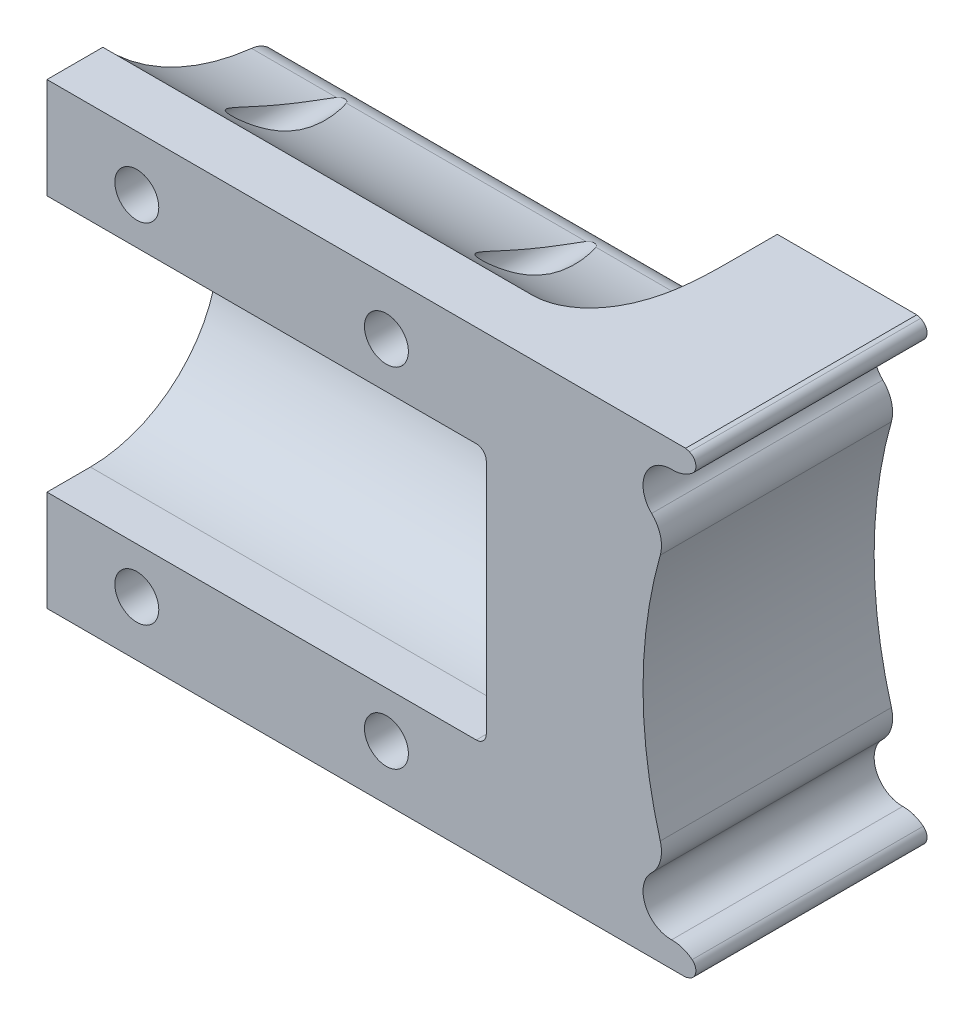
SolidWorks part; units mm, degrees
ref_plane "Front Plane" through (0, 0, 0) normal (1, 0, 0) x (0, 1, 0)
ref_plane "Top Plane" through (0, 0, 0) normal (0, 0, 1) x (0, 1, 0)
ref_plane "Right Plane" through (0, 0, 0) normal (0, 1, 0) x (-1, 0, 0)
sketch "Sketch1" plane through (0, 0, 0) normal (1, 0, 0) x (0, 1, 0)
  line L0 (-11.9398, 0) -> (-22.9398, 0)
  line L1 (-22.9398, 0) -> (-22.9398, -6)
  line L2 (-15.25, -23.55) -> (15.25, -23.55)
  line L3 (11.9398, 0) -> (22.9398, 0)
  line L4 (22.9398, 0) -> (22.9398, -6)
  arc A0 (-11.9398, 0) -> (11.9398, 0) centre (0, -4.75) ccw
  arc A1 (-22.9398, -6) -> (-15.25, -23.55) centre (-39.1215, -23.55) cw
  arc A3 (22.9398, -6) -> (15.25, -23.55) centre (39.1215, -23.55) ccw
  point P8 (0, -23.55)
  dimension "D2" = 12.85
  dimension "D5" = 30.5
  dimension "D1" = 4.75
  dimension "D3" = 11
  dimension "D4" = 6
  dimension "D6" = 23.55
extrude "Boss-Extrude1" add sketch "Sketch1" along normal blind 50
sketch "Sketch2" plane through (50, 0, 0) normal (1, 0, 0) x (0, 1, 0)
  line L0 (-11.9398, 0) -> (11.9398, 0)
  arc A2 (-11.9398, 0) -> (11.9398, 0) centre (0, -4.75) ccw
  arc A3 (-11.9398, 0) -> (11.9398, 0) centre (0, -4.75) ccw
  dimension "D1" = 0
extrude "Boss-Extrude2" add sketch "Sketch2" against normal blind 6
sketch "Sketch3" plane through (0, 0, 0) normal (0, 0, 1) x (1, 0, 0)
  line L0 (9, 17.4398) -> (34, 17.4398) construction
  line L2 (34, 17.4398) -> (34, -17.4398) construction
  line L4 (0, 22.9398) -> (0, 11.9398) construction
  line L6 (0, -11.9398) -> (0, -22.9398) construction
  circle A4 centre (9, 17.4398) radius 2.1
  circle A5 centre (34, 17.4398) radius 2.1
  circle A6 centre (9, -17.4398) radius 2.1
  circle A7 centre (34, -17.4398) radius 2.1
  point P10 (0, 17.4398)
  point P18 (0, -17.4398)
  dimension "D1" = 4.2
  dimension "D2" = 25
  dimension "D3" = 9
extrude "Cut-Extrude1" cut sketch "Sketch3" against normal through all
sketch "Sketch4" plane through (0, 0, 0) normal (0, 0, 1) x (1, 0, 0)
  line L0 (50, 0) -> (105, 0) construction
  line L1 (50, 22.9398) -> (50, -22.9398) construction
  line L2 (65.7061, 22.9398) -> (50, 22.9398)
  line L3 (50, 22.9398) -> (50, -22.9398)
  line L4 (50, -22.9398) -> (65.7061, -22.9398)
  arc A0 (65.7061, 22.9398) -> (65.7061, -22.9398) centre (105, 0) ccw
  dimension "D1" = 45.5
  dimension "D2" = 55
extrude "Boss-Extrude3" add sketch "Sketch4" against normal up to surface (23.55 mm away) contours L0 L4 A0 M13 | L3 L0 A0 L2
sketch "Sketch5" plane through (0, 0, 0) normal (0, 0, 1) x (1, 0, 0)
  line L0 (105, 0) -> (62.5015, 17.6034) construction
  line L1 (105, 0) -> (59.5, 0) construction
  line L2 (61.4737, 15.122) -> (63.5294, 20.0849) construction
  line L3 (62.5659, 20.6027) -> (60.4262, 15.4371) construction
  line L4 (62.5659, -20.6027) -> (60.4262, -15.4371) construction
  line L5 (61.4737, -15.122) -> (63.5294, -20.0849) construction
  arc A0 (65.7061, 22.9398) -> (65.7061, -22.9398) centre (105, 0) ccw construction
  arc A1 (62.5659, 20.6027) -> (60.4262, 15.4371) centre (62.5015, 17.6034) ccw
  arc A2 (60.4262, 15.4371) -> (61.2365, 12.4503) centre (58.3509, 13.2707) cw
  arc A3 (62.5659, 20.6027) -> (65.2509, 22.1418) centre (62.6303, 23.6021) ccw
  arc A4 (65.2509, 22.1418) -> (61.2364, 12.4499) centre (105, 0) ccw
  arc A5 (65.2509, -22.1418) -> (61.2364, -12.4499) centre (105, 0) cw
  arc A6 (62.5659, -20.6027) -> (65.2509, -22.1418) centre (62.6303, -23.6021) cw
  arc A7 (60.4262, -15.4371) -> (61.2365, -12.4503) centre (58.3509, -13.2707) ccw
  arc A8 (62.5659, -20.6027) -> (60.4262, -15.4371) centre (62.5015, -17.6034) cw
  point P16 (62.5015, 17.6034)
  point P26 (62.5015, -17.6034)
  dimension "D3" = 3
  dimension "D5" = 3
  dimension "D6" = 3
  dimension "D1" = 45.5
  dimension "D2" = 22.5
  dimension "D4" = 46
  dimension "D7" = 10.49
extrude "Cut-Extrude2" cut sketch "Sketch5" against normal through all contours A8 A6 A7 M15 | A3 A1 A2 M15
fillet "Fillet2" radius 3 2 edges at (25, -15.25, -23.55) (25, 15.25, -23.55)
fillet "Fillet5" radius 5 2 edges at (65.7061, -22.9398, -11.775) (65.7061, 22.9398, -11.775)
fillet "Fillet7" radius 7 4 edges at (50, -14.4174, -22.7866) (50, 14.4174, -22.7866) (50, -17.8266, -12.7622) (50, 17.8266, -12.7622)
sketch "Sketch7" plane through (0, 0, 0) normal (0, 0, 1) x (1, 0, 0)
  line L7 (62.5409, 22.9398) -> (63.9692, 22.9398)
  line L8 (62.5409, -22.9398) -> (63.9692, -22.9398)
  line L14 (-0.2, -23.1398) -> (62.5409, -23.1398)
  line L15 (62.5409, 23.1398) -> (-0.2, 23.1398)
  line L16 (-0.2, 23.1398) -> (-0.2, 11.7398)
  line L17 (-0.2, 11.7398) -> (43.8, 11.7398)
  line L18 (43.8, 11.7398) -> (43.8, -11.7398)
  line L19 (43.8, -11.7398) -> (-0.2, -11.7398)
  line L20 (-0.2, -11.7398) -> (-0.2, -23.1398)
  line L37 (0, -22.9398) -> (62.5409, -22.9398)
  line L38 (62.5409, 22.9398) -> (0, 22.9398)
  line L39 (0, 22.9398) -> (0, 11.9398)
  line L40 (0, 11.9398) -> (44, 11.9398)
  line L41 (44, 11.9398) -> (44, -11.9398)
  line L42 (44, -11.9398) -> (0, -11.9398)
  line L43 (0, -11.9398) -> (0, -22.9398)
  arc A18 (62.5409, -23.1398) -> (65.5108, -22.2083) centre (62.5409, -17.9398) ccw
  arc A19 (65.5108, -22.2083) -> (62.5616, -20.4028) centre (62.6303, -23.6021) ccw
  arc A20 (60.5646, -15.5815) -> (62.5616, -20.4028) centre (62.5015, -17.6034) ccw
  arc A21 (60.5646, -15.5815) -> (61.4289, -12.3955) centre (58.3509, -13.2707) ccw
  arc A22 (61.4289, 12.3956) -> (61.4289, -12.3955) centre (105, 0) ccw
  arc A23 (61.4289, 12.3956) -> (60.5646, 15.5815) centre (58.3509, 13.2707) ccw
  arc A24 (62.5616, 20.4028) -> (60.5646, 15.5815) centre (62.5015, 17.6034) ccw
  arc A25 (62.5616, 20.4028) -> (65.5108, 22.2083) centre (62.6303, 23.6021) ccw
  arc A26 (65.5108, 22.2083) -> (62.5409, 23.1398) centre (62.5409, 17.9398) ccw
  arc A27 (63.9692, -22.9398) -> (65.5108, -22.2083) centre (62.5409, -17.9398) ccw
  arc A28 (65.5108, -22.2083) -> (62.5616, -20.4028) centre (62.6303, -23.6021) ccw
  arc A29 (60.5646, -15.5815) -> (62.5616, -20.4028) centre (62.5015, -17.6034) ccw
  arc A30 (60.5646, -15.5815) -> (61.4289, -12.3955) centre (58.3509, -13.2707) ccw
  arc A31 (61.4289, 12.3956) -> (61.4289, -12.3955) centre (105, 0) ccw
  arc A32 (61.4289, 12.3956) -> (60.5646, 15.5815) centre (58.3509, 13.2707) ccw
  arc A33 (62.5616, 20.4028) -> (60.5646, 15.5815) centre (62.5015, 17.6034) ccw
  arc A34 (62.5616, 20.4028) -> (65.5108, 22.2083) centre (62.6303, 23.6021) ccw
  arc A35 (65.5108, 22.2083) -> (63.9692, 22.9398) centre (62.5409, 17.9398) ccw
  arc A45 (62.5409, -22.9398) -> (65.2509, -22.1418) centre (62.5409, -17.9398) ccw
  arc A46 (65.2509, -22.1418) -> (62.5659, -20.6027) centre (62.6303, -23.6021) ccw
  arc A47 (60.4262, -15.4371) -> (62.5659, -20.6027) centre (62.5015, -17.6034) ccw
  arc A48 (60.4262, -15.4371) -> (61.2365, -12.4503) centre (58.3509, -13.2707) ccw
  arc A49 (61.2365, 12.4503) -> (61.2365, -12.4503) centre (105, 0) ccw
  arc A50 (61.2365, 12.4503) -> (60.4262, 15.4371) centre (58.3509, 13.2707) ccw
  arc A51 (62.5659, 20.6027) -> (60.4262, 15.4371) centre (62.5015, 17.6034) ccw
  arc A52 (62.5659, 20.6027) -> (65.2509, 22.1418) centre (62.6303, 23.6021) ccw
  arc A53 (65.2509, 22.1418) -> (62.5409, 22.9398) centre (62.5409, 17.9398) ccw
  arc A54 (62.5409, -22.9398) -> (65.2509, -22.1418) centre (62.5409, -17.9398) ccw
  arc A55 (65.2509, -22.1418) -> (62.5659, -20.6027) centre (62.6303, -23.6021) ccw
  arc A56 (60.4262, -15.4371) -> (62.5659, -20.6027) centre (62.5015, -17.6034) ccw
  arc A57 (60.4262, -15.4371) -> (61.2365, -12.4503) centre (58.3509, -13.2707) ccw
  arc A58 (61.2365, 12.4503) -> (61.2365, -12.4503) centre (105, 0) ccw
  arc A59 (61.2365, 12.4503) -> (60.4262, 15.4371) centre (58.3509, 13.2707) ccw
  arc A60 (62.5659, 20.6027) -> (60.4262, 15.4371) centre (62.5015, 17.6034) ccw
  arc A61 (62.5659, 20.6027) -> (65.2509, 22.1418) centre (62.6303, 23.6021) ccw
  arc A62 (65.2509, 22.1418) -> (62.5409, 22.9398) centre (62.5409, 17.9398) ccw
  dimension "D1" = 0.2
  dimension "D2" = 0
extrude "Boss-Extrude4" add sketch "Sketch7" against normal up to surface (23.55 mm away) contours A34 A35 L7 L8 A27 A28 A29 A30 A31 A32 A33 M52 M51 M50 M49 M48 M47 M46 M45 M44
fillet "Fillet8" radius 1 2 edges at (65.5108, 22.2083, -11.775) (65.5108, -22.2083, -11.775)
sketch "Sketch8" plane through (0, 0, 0) normal (0, 0, 1) x (1, 0, 0)
  circle A0 centre (9, 17.4398) radius 2.2
  circle A1 centre (34, 17.4398) radius 2.2
  circle A2 centre (9, -17.4398) radius 2.2
  circle A3 centre (34, -17.4398) radius 2.2
  dimension "D1" = 4.4
extrude "Cut-Extrude3" cut sketch "Sketch8" against normal blind 5
sketch "Sketch9" plane through (0, 0, -23.55) normal (0, 0, -1) x (1, 0, 0)
  line L0 (9, 17.4398) -> (9, -17.4398) construction
  line L1 (34, 17.4398) -> (34, -17.4398) construction
  circle A0 centre (9, 0) radius 5
  circle A1 centre (34, 0) radius 5
  dimension "D1" = 10
extrude "Cut-Extrude4" cut sketch "Sketch9" against normal blind 4
sketch "Sketch10" plane through (0, 0, -19.55) normal (0, 0, -1) x (1, 0, 0)
  circle A0 centre (34, 0) radius 2.1
  circle A1 centre (9, 0) radius 2.1
  dimension "D1" = 4.2
extrude "Cut-Extrude5" cut sketch "Sketch10" against normal through all
fillet "Fillet9" radius 1 2 edges at (29, 0, -19.55) (4, 0, -19.55)
sketch "Sketch11" plane through (0, 0, 0) normal (-1, 0, 0) x (0, -1, 0)
  line L0 (-12.85, -4.75) -> (-12.85, 0)
  line L1 (-22.9398, 0) -> (-11.9398, 0) construction
  line L2 (-12.85, 0) -> (-11.9398, 0)
  line L3 (12.85, -4.75) -> (12.85, 0)
  line L4 (11.9398, 0) -> (22.9398, 0) construction
  line L5 (12.85, 0) -> (11.9398, 0)
  arc A0 (-11.9398, 0) -> (11.9398, 0) centre (0, -4.75) ccw construction
  arc A1 (-11.9398, 0) -> (11.9398, 0) centre (0, -4.75) ccw construction
  arc A2 (-11.9398, 0) -> (-12.85, -4.75) centre (0, -4.75) ccw
  arc A3 (11.9398, 0) -> (12.85, -4.75) centre (0, -4.75) cw
extrude "Cut-Extrude6" cut sketch "Sketch11" against normal up to surface (44 mm away)
fillet "Fillet10" radius 1 3 edges at (44, -12.85, -2.375) (44, 12.85, -2.375) (44, 0, -17.6)
sketch "Sketch12" plane through (0, 0, 0) normal (0, 0, 1) x (1, 0, 0)
  line L0 (63.9692, -22.9398) -> (0, -22.9398) construction
  line L1 (0, 22.9398) -> (77.4495, 22.9398)
  line L2 (0, 22.9398) -> (0, -22.9398)
  line L3 (0, -22.9398) -> (77.4495, -22.9398)
  line L4 (77.4495, 22.9398) -> (77.4495, -22.9398)
extrude "Cut-Extrude7" cut sketch "Sketch12" against normal blind 0.4
sketch "Sketch13" plane through (0, 0, -23.55) normal (0, 0, -1) x (1, 0, 0)
  line L0 (9, 0) -> (34, 0) construction
  circle A0 centre (21.5, 0) radius 2.2
  dimension "D1" = 4.4
extrude "Cut-Extrude8" cut sketch "Sketch13" against normal blind 5
